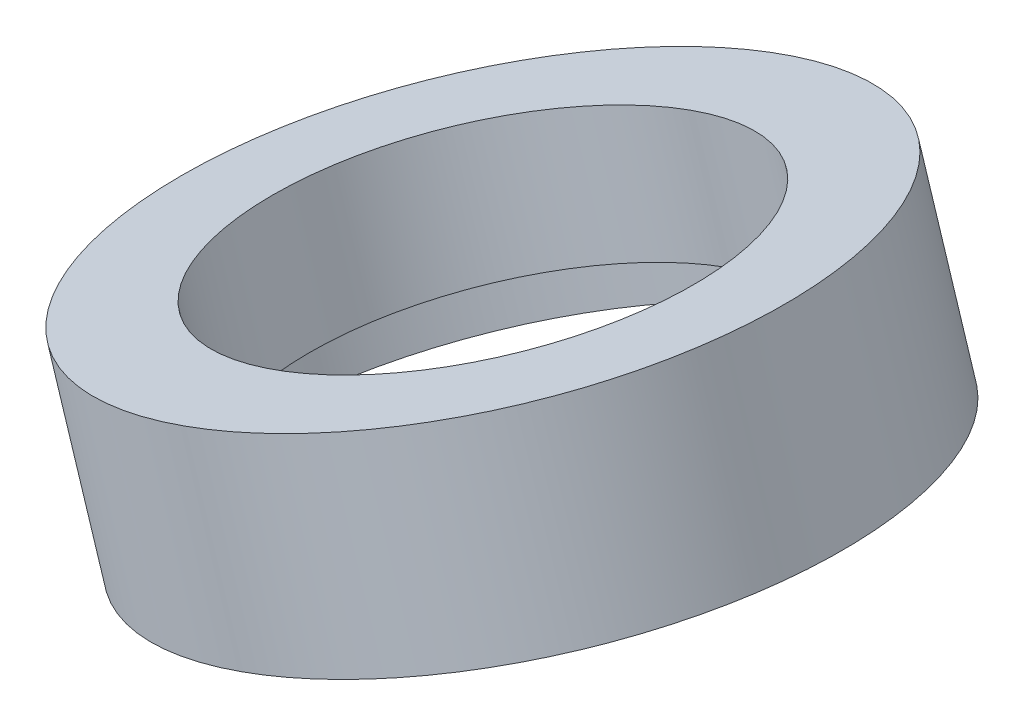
SolidWorks part; units mm, degrees
ref_plane "Alzado" through (0, 0, 0) normal (0, 0, 1) x (1, 0, 0)
ref_plane "Planta" through (0, 0, 0) normal (0, 1, 0) x (1, 0, 0)
ref_plane "Vista lateral" through (0, 0, 0) normal (1, 0, 0) x (0, 0, -1)
sketch "Sk_Cazoleta" plane through (0, 0, 0) normal (0, 0, 1) x (1, 0, 0)
  line L0 (373.4203, 555.0431) -> (379.3333, 556.9075)
  line L1 (379.3333, 556.9075) -> (383.0922, 544.9861)
  line L2 (383.0922, 544.9861) -> (382.2339, 544.7154)
  line L3 (382.2339, 544.7154) -> (380.8807, 549.0071)
  line L4 (380.8807, 549.0071) -> (375.826, 547.4134)
  line L5 (375.826, 547.4134) -> (373.4203, 555.0431)
  line L6 (358.2786, 555.5114) -> (368.8036, 522.1314) construction
revolve "Cazoleta" add sketch "Sk_Cazoleta" angle 360 about L6
